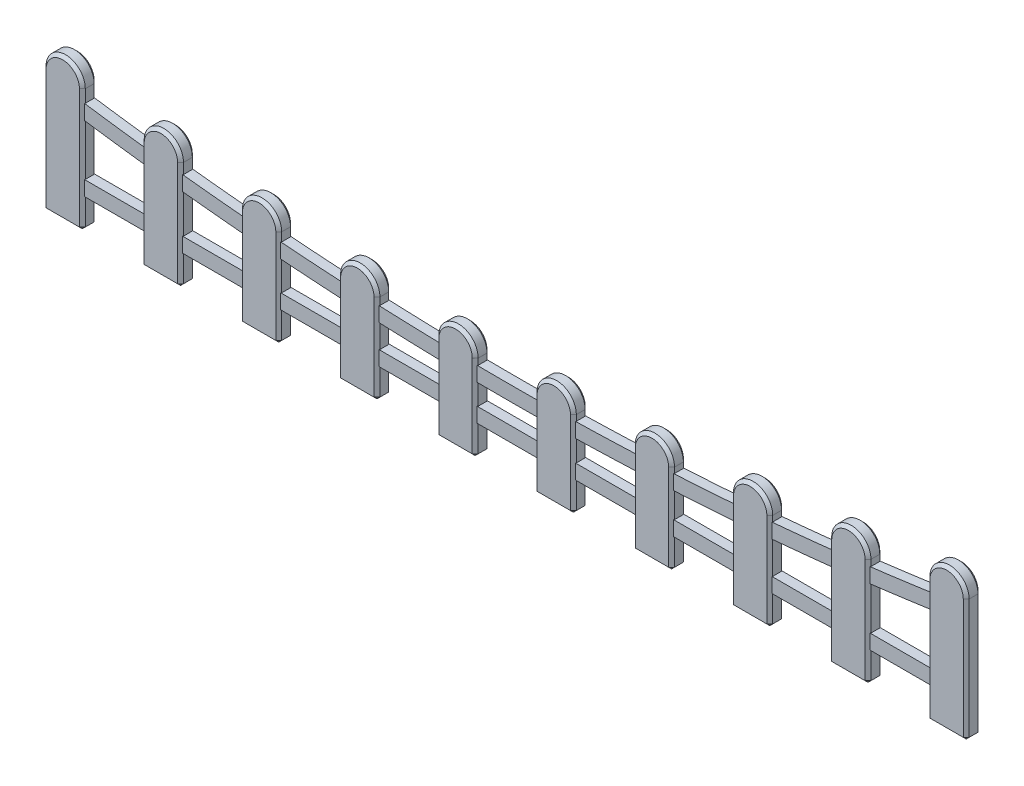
SolidWorks part; units mm, degrees
ref_plane "Спереди" through (0, 0, 0) normal (0, 0, 1) x (1, 0, 0)
ref_plane "Сверху" through (0, 0, 0) normal (0, 1, 0) x (1, 0, 0)
ref_plane "Справа" through (0, 0, 0) normal (1, 0, 0) x (0, 0, -1)
sketch "Эскиз1" plane through (0, 0, 0) normal (0, 0, 1) x (1, 0, 0)
  line L0 (12.0002, 0) -> (12.0002, 21.854)
  line L1 (0, 0) -> (-8, 0)
  line L2 (0, 0) -> (0, 25)
  line L3 (0, 25) -> (-8, 25) construction
  line L4 (-8, 0) -> (-8, 25)
  line L6 (20.0002, 0) -> (20.0002, 21.9994)
  line L7 (20.0002, 0) -> (12.0002, 0)
  line L8 (32.0004, 0) -> (32.0004, 19.8819)
  line L10 (40.0004, 0) -> (40.0004, 19.7598)
  line L11 (40.0004, 0) -> (32.0004, 0)
  line L12 (52.0005, 0) -> (52.0005, 18.3661)
  line L14 (60.0005, 0) -> (60.0005, 18.2719)
  line L15 (60.0005, 0) -> (52.0005, 0)
  line L16 (72.0007, 0) -> (72.0007, 17.5295)
  line L18 (80.0007, 0) -> (80.0007, 17.4701)
  line L19 (80.0007, 0) -> (72.0007, 0)
  line L20 (92.0009, 0) -> (92.0009, 17.4701)
  line L22 (100.0009, 0) -> (100.0009, 17.5295)
  line L23 (100.0009, 0) -> (92.0009, 0)
  line L24 (112.0011, 0) -> (112.0011, 18.0639)
  line L26 (120.0011, 0) -> (120.0011, 18.2719)
  line L27 (120.0011, 0) -> (112.0011, 0)
  line L28 (132.0013, 0) -> (132.0013, 19.4023)
  line L30 (140.0013, 0) -> (140.0013, 19.7598)
  line L31 (140.0013, 0) -> (132.0013, 0)
  line L32 (152.0014, 0) -> (152.0014, 21.9997)
  line L34 (160.0014, 0) -> (160.0014, 21.9995)
  line L35 (160.0014, 0) -> (152.0014, 0)
  line L36 (172.0016, 0) -> (172.0016, 25)
  line L37 (180.0016, 25) -> (172.0016, 25) construction
  line L38 (180.0016, 0) -> (180.0016, 25)
  line L39 (180.0016, 0) -> (172.0016, 0)
  line L40 (156.0034, 21.9995) -> (160.0014, 21.9995) construction
  line L41 (152.0072, 22.119) -> (152.0014, 21.9997)
  line L42 (20, 25) -> (18.6463, 25)
  line L43 (40.0004, 25) -> (32.0004, 25)
  line L44 (60.0005, 25) -> (52.0005, 25)
  line L45 (160, 25) -> (158.6443, 25)
  line L46 (132.0126, 20.0218) -> (132.0013, 19.4023)
  line L47 (140.0013, 25) -> (132.0013, 25)
  line L48 (80, 17.4936) -> (80.0007, 17.4701)
  line L49 (120.0011, 25) -> (112.0011, 25)
  line L50 (100.0009, 25) -> (92.0009, 25)
  line L51 (80.0007, 25) -> (72.0007, 25)
  line L52 (92.0022, 17.6045) -> (92.0009, 17.4701)
  line L53 (112.0011, 18.0639) -> (112.0028, 18.2443)
  arc A0 (0, 25) -> (-8, 25) centre (-4, 25) ccw
  arc A1 (180.0016, 25) -> (172.0016, 25) centre (176.0016, 25) ccw
  arc A2 (-4, 25) -> (0, 24.3384) centre (86.0008, 556.7113) ccw construction
  arc A3 (12.0015, 22.538) -> (20.0002, 21.4908) centre (86.0008, 556.7113) ccw construction
  arc A4 (32.0013, 20.1471) -> (40.0004, 19.4023) centre (86.0008, 556.7113) ccw construction
  arc A5 (52.0011, 18.5096) -> (60.0005, 18.0639) centre (86.0008, 556.7113) ccw construction
  arc A6 (72.0007, 17.6185) -> (80.0007, 17.4701) centre (86.0008, 556.7113) ccw construction
  arc A7 (92.0009, 17.4701) -> (100.0009, 17.6185) centre (86.0008, 556.7113) ccw construction
  arc A8 (112.0011, 18.0639) -> (120.0011, 18.5096) centre (86.0008, 556.7113) ccw construction
  arc A9 (132.0013, 19.4023) -> (140.0013, 20.1472) centre (86.0008, 556.7113) ccw construction
  arc A10 (152.0029, 21.491) -> (160, 22.5379) centre (86.0008, 556.7113) ccw construction
  arc A11 (172.0016, 24.3384) -> (176.0016, 25) centre (86.0008, 556.7113) ccw construction
  arc A12 (160.0014, 21.9995) -> (152.0072, 22.119) centre (156.0034, 21.9995) ccw
  arc A13 (140.0013, 19.7598) -> (132.0126, 20.0218) centre (136.0027, 19.7598) ccw
  arc A14 (120.0011, 18.2719) -> (112.0028, 18.2443) centre (116.0019, 18.2719) ccw
  arc A15 (100.0009, 17.5295) -> (92.0022, 17.6045) centre (96.0012, 17.5295) ccw
  arc A16 (80, 17.4936) -> (72.0007, 17.5295) centre (76.0004, 17.5295) ccw
  arc A17 (60.0005, 18.2719) -> (52.0005, 18.3661) centre (56, 18.2719) ccw
  arc A18 (40.0004, 19.7598) -> (32.0004, 19.8819) centre (35.9994, 19.7598) ccw
  arc A19 (20.0002, 21.9994) -> (12.0002, 21.854) centre (15.9989, 21.9994) ccw
  dimension "D4" = 7.9961
  dimension "D1" = 8
  dimension "D3" = 25
  dimension "D2" = 10
extrude "Бобышка-Вытянуть1" add sketch "Эскиз1" along normal mid plane 3
sketch "Эскиз2" plane through (0, 0, 0) normal (0, 0, 1) x (1, 0, 0)
  line L0 (172.0016, 0) -> (180.0016, 0) construction
  line L1 (-3.8461, 9) -> (177.5502, 9)
  line L2 (-3.8461, 9) -> (-3.8461, 6)
  line L3 (-3.8461, 6) -> (177.5502, 6)
  line L4 (177.5502, 9) -> (177.5502, 6)
  line L5 (-8, 0) -> (0, 0) construction
  line L6 (176.4607, 23) -> (176.9115, 20.0341)
  line L7 (-3.8663, 23) -> (-4.3171, 20.0341)
  arc A0 (-3.8663, 23) -> (176.4607, 23) centre (86.2972, 616.1868) ccw
  arc A1 (-4.3171, 20.0341) -> (176.9115, 20.0341) centre (86.2972, 616.1868) ccw
  arc A2 (-10.6847, 24.0766) -> (176.4607, 23) centre (86.2972, 616.1868) ccw construction
  arc A3 (-11.1697, 21.116) -> (176.9115, 20.0341) centre (86.2972, 616.1868) ccw construction
  dimension "D6" = 600
  dimension "D1" = 6
  dimension "D2" = 3
  dimension "D4" = 23
  dimension "D5" = 23
  dimension "D3" = 3
extrude "Бобышка-Вытянуть2" add sketch "Эскиз2" along normal mid plane 2
chamfer "Фаска1" distance 0.6 angle 45 110 edges at (172.0016, 0, 0) (180.0016, 12.5, -1.5) (176.0016, 29, -1.5) (172.0016, 12.5, -1.5) (176.0016, 0, -1.5) (180.0016, 0, 0) (172.0016, 12.5, 1.5) (176.0016, 29, 1.5) (180.0016, 12.5, 1.5) (176.0016, 0, 1.5) (152.0014, 0, 0) (152.0014, 10.9999, -1.5) (156.0014, 0, -1.5) (152.0043, 22.0593, -1.5) (156.0631, 25.9971, -1.5) (160.0014, 10.9998, -1.5) (160.0014, 0, 0) (156.0631, 25.9971, 1.5) (160.0014, 10.9998, 1.5) (156.0014, 0, 1.5) (152.0014, 10.9999, 1.5) (152.0043, 22.0593, 1.5) (132.0013, 0, 0) (140.0013, 9.8799, -1.5) (136.1337, 23.7563, -1.5) (132.007, 19.712, -1.5) (132.0013, 9.7011, -1.5) (136.0013, 0, -1.5) (140.0013, 0, 0) (132.0013, 9.7011, 1.5) (132.007, 19.712, 1.5) (136.1337, 23.7563, 1.5) (140.0013, 9.8799, 1.5) (136.0013, 0, 1.5) (112.0011, 0, 0) (112.002, 18.1541, -1.5) (112.0011, 9.0319, -1.5) (116.0011, 0, -1.5) (115.9881, 22.271, -1.5) (120.0011, 9.1359, -1.5) (120.0011, 0, 0) (120.0011, 9.1359, 1.5) (116.0011, 0, 1.5) (112.0011, 9.0319, 1.5) (112.002, 18.1541, 1.5) (115.9881, 22.271, 1.5) (92.0009, 0, 0) (92.0015, 17.5373, -1.5) (92.0009, 8.7351, -1.5) (96.0009, 0, -1.5) (96.0387, 21.529, -1.5) (100.0009, 8.7647, -1.5) (100.0009, 0, 0) (100.0009, 8.7647, 1.5) (96.0009, 0, 1.5) (92.0009, 8.7351, 1.5) (92.0015, 17.5373, 1.5) (96.0387, 21.529, 1.5) (72.0007, 0, 0) (80.0007, 8.7351, -1.5) (80.0004, 17.4819, -1.5) (76.0184, 21.5292, -1.5) (72.0007, 8.7647, -1.5) (76.0007, 0, -1.5) (80.0007, 0, 0) (72.0007, 8.7647, 1.5) (76.0184, 21.5292, 1.5) (80.0004, 17.4819, 1.5) (80.0007, 8.7351, 1.5) (76.0007, 0, 1.5) (52.0005, 0, 0) (52.0005, 9.183, -1.5) (56.0005, 0, -1.5) (56.0471, 22.2722, -1.5) (60.0005, 9.1359, -1.5) (60.0005, 0, 0) (60.0005, 9.1359, 1.5) (56.0005, 0, 1.5) (52.0005, 9.183, 1.5) (56.0471, 22.2722, 1.5) (32.0004, 0, 0) (32.0004, 9.941, -1.5) (36.0004, 0, -1.5) (36.0605, 23.7603, -1.5) (40.0004, 9.8799, -1.5) (40.0004, 0, 0) (40.0004, 9.8799, 1.5) (36.0004, 0, 1.5) (32.0004, 9.941, 1.5) (36.0605, 23.7603, 1.5) (12.0002, 0, 0) (20.0002, 10.9997, -1.5) (15.9262, 26.0001, -1.5) (12.0002, 10.927, -1.5) (16.0002, 0, -1.5) (20.0002, 0, 0) (12.0002, 10.927, 1.5) (15.9262, 26.0001, 1.5) (20.0002, 10.9997, 1.5) (16.0002, 0, 1.5) (-8, 0, 0) (-4, 29, -1.5) (-8, 12.5, -1.5) (-4, 0, -1.5) (0, 12.5, -1.5) (0, 0, 0) (-4, 0, 1.5) (-8, 12.5, 1.5) (-4, 29, 1.5) (0, 12.5, 1.5)
